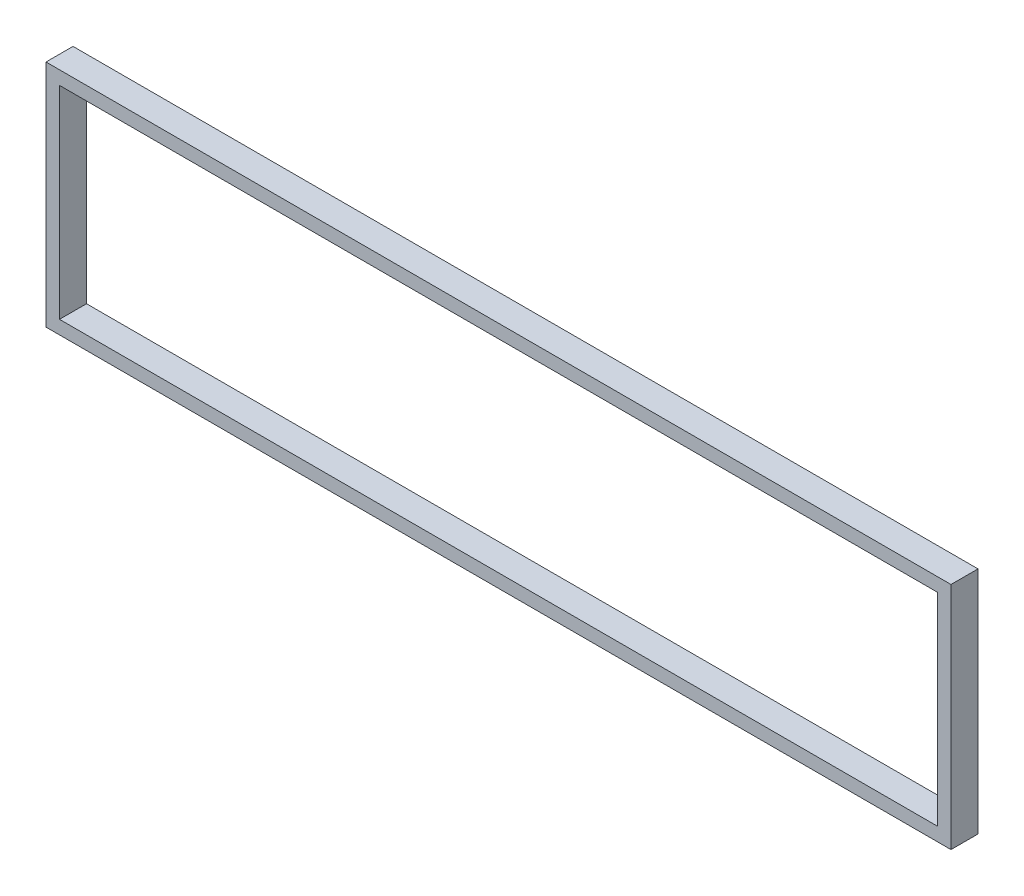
SolidWorks part; units mm, degrees
ref_plane "Plane1" through (0, 0, 0) normal (0, 0, 1) x (1, 0, 0)
ref_plane "Plane2" through (0, 0, 0) normal (0, 1, 0) x (1, 0, 0)
ref_plane "Plane3" through (0, 0, 0) normal (1, 0, 0) x (0, 0, -1)
sketch "Sketch1" plane through (0, 0, 0) normal (0, 0, 1) x (1, 0, 0)
  line L0 (-54200, 150) -> (-54200, 0) construction
  line L1 (-54500, 150) -> (-53850, 150)
  line L2 (-54500, 150) -> (-54500, 0)
  line L3 (-54500, 0) -> (-53850, 0)
  line L4 (-53850, 150) -> (-53850, 0)
  line L5 (-54510, 160) -> (-53840, 160)
  line L6 (-54510, 160) -> (-54510, -10)
  line L7 (-54510, -10) -> (-53840, -10)
  line L8 (-53840, 160) -> (-53840, -10)
  dimension "D1" = 150
  dimension "D2" = 170
  dimension "D3" = 650
  dimension "D4" = 670
  dimension "D5" = 300
  dimension "D6" = 10
extrude "Base-Extrude" add sketch "Sketch1" along normal mid plane 20
